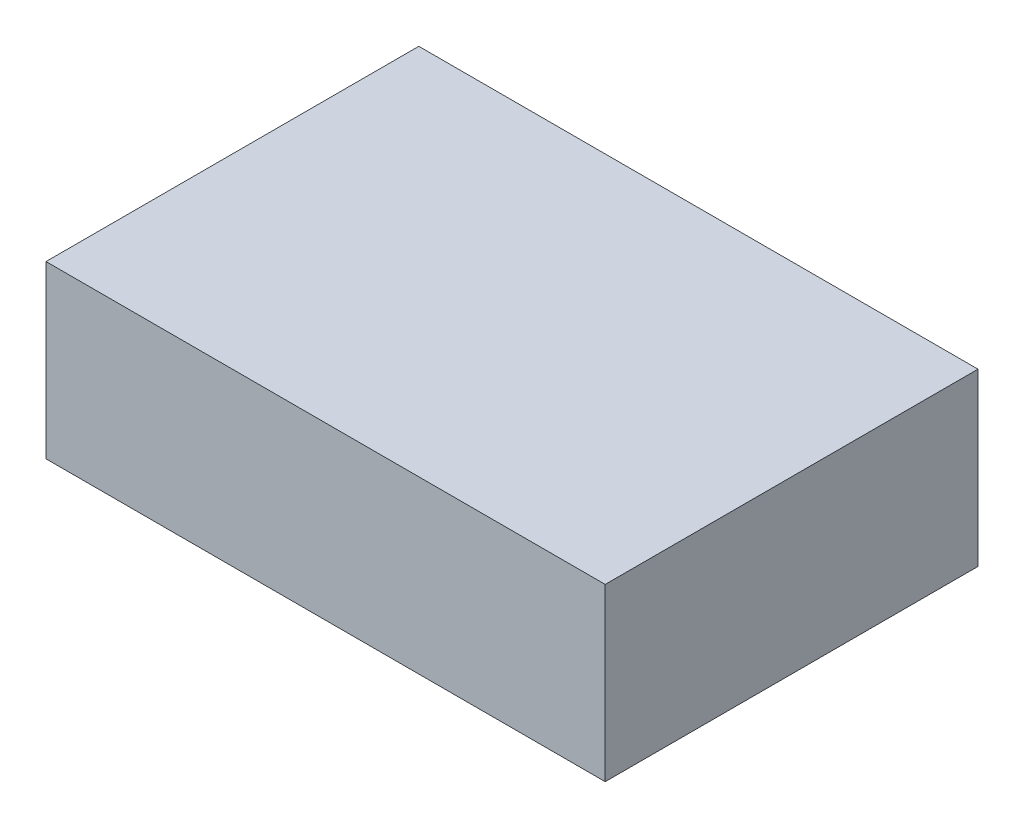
SolidWorks part; units mm, degrees
ref_plane "Front Plane" through (0, 0, 0) normal (0, 0, 1) x (1, 0, 0)
ref_plane "Top Plane" through (0, 0, 0) normal (0, 1, 0) x (1, 0, 0)
ref_plane "Right Plane" through (0, 0, 0) normal (1, 0, 0) x (0, 0, -1)
sketch "Sketch1" plane through (0, 0, 0) normal (0, 1, 0) x (1, 0, 0)
  line L1 (0, 0) -> (45.72, 0)
  line L2 (0, 0) -> (0, 30.48)
  line L3 (0, 30.48) -> (45.72, 30.48)
  line L4 (45.72, 0) -> (45.72, 30.48)
  point P4 (0, 0)
  point P5 (0, 0)
  point P6 (0, 0)
  point P7 (0, 0)
extrude "Boss-Extrude1" add sketch "Sketch1" along normal blind 13.97
